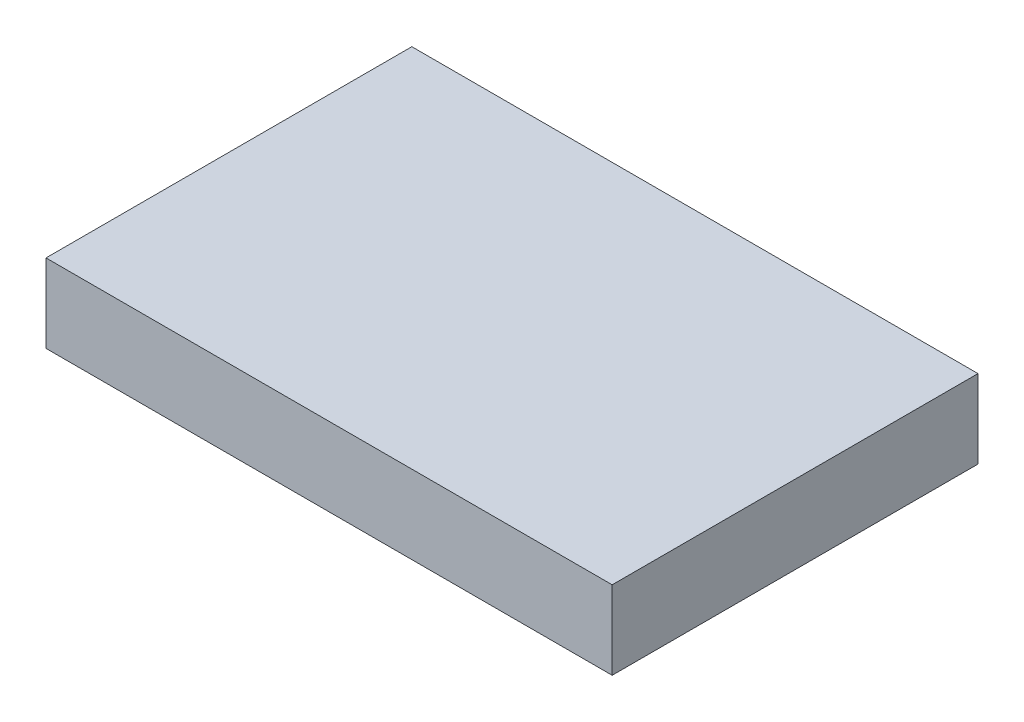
SolidWorks part; units mm, degrees
ref_plane "Front Plane" through (0, 0, 0) normal (0, 0, 1) x (1, 0, 0)
ref_plane "Top Plane" through (0, 0, 0) normal (0, 1, 0) x (1, 0, 0)
ref_plane "Right Plane" through (0, 0, 0) normal (1, 0, 0) x (0, 0, -1)
sketch "Sketch1" plane through (0, 0, 0) normal (0, 1, 0) x (1, 0, 0)
  line L1 (0, 0) -> (65, 0)
  line L2 (0, 0) -> (0, 42)
  line L3 (0, 42) -> (65, 42)
  line L4 (65, 0) -> (65, 42)
  dimension "D1" = 42
  dimension "D2" = 65
extrude "Boss-Extrude2" add sketch "Sketch1" along normal blind 9
